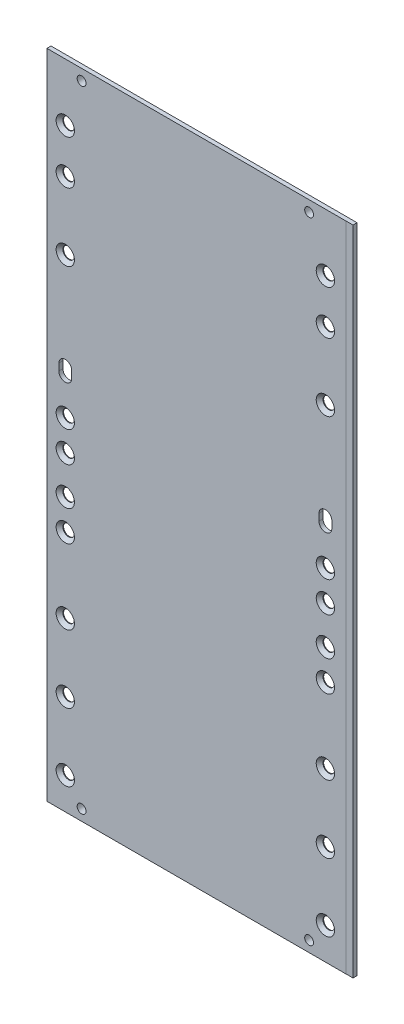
SolidWorks part; units mm, degrees
ref_plane "Front Plane" through (0, 0, 0) normal (0, 0, 1) x (1, 0, 0)
ref_plane "Top Plane" through (0, 0, 0) normal (0, 1, 0) x (1, 0, 0)
ref_plane "Right Plane" through (0, 0, 0) normal (1, 0, 0) x (0, 0, -1)
sketch "Sketch1" plane through (0, 0, 0) normal (0, 0, 1) x (1, 0, 0)
  line L0 (-36.4319, 3.9744) -> (-36.4319, 1.9744) construction
  line L1 (-41.8319, 82.5744) -> (48.3681, 82.5744)
  line L2 (-41.8319, 82.5744) -> (-41.8319, -109.6256)
  line L3 (-41.8319, -109.6256) -> (48.3681, -109.6256)
  line L4 (48.3681, 82.5744) -> (48.3681, -109.6256)
  line L5 (-34.5319, 3.9744) -> (-34.5319, 1.9744)
  line L6 (-38.3319, 3.9744) -> (-38.3319, 1.9744)
  circle A0 centre (-31.6319, 79.3744) radius 1.3
  circle A1 centre (-36.4319, 65.5744) radius 1.7
  circle A2 centre (-36.4319, 52.5744) radius 1.7
  circle A3 centre (-36.4319, 32.5744) radius 1.7
  circle A4 centre (-36.4319, -9.0256) radius 1.7
  circle A5 centre (-36.4319, -18.0256) radius 1.7
  circle A6 centre (-36.4319, -29.2256) radius 1.7
  circle A7 centre (-36.4319, -38.2256) radius 1.7
  circle A8 centre (-36.4319, -60.2256) radius 1.7
  circle A9 centre (-36.4319, -80.2256) radius 1.7
  circle A10 centre (-36.4319, -100.2256) radius 1.7
  arc A11 (-34.5319, 3.9744) -> (-38.3319, 3.9744) centre (-36.4319, 3.9744) ccw
  arc A12 (-38.3319, 1.9744) -> (-34.5319, 1.9744) centre (-36.4319, 1.9744) ccw
  circle A13 centre (-31.6319, -106.4256) radius 1.3
  point P28 (-36.4319, 2.9744)
  point P35 (-36.4319, 0.0744)
  point P36 (-36.4319, 5.8744)
  point P37 (-38.3319, 2.9744)
  dimension "D3" = 2.6
  dimension "D4" = 3.4
  dimension "D5" = 3.4
  dimension "D6" = 3.4
  dimension "D7" = 3.4
  dimension "D8" = 3.4
  dimension "D9" = 3.4
  dimension "D10" = 3.4
  dimension "D11" = 3.4
  dimension "D12" = 3.4
  dimension "D13" = 3.4
  dimension "D14" = 2.6
  dimension "D1" = 90.2
  dimension "D2" = 192.2
  dimension "D15" = 3.2
  dimension "D16" = 3.2
  dimension "D17" = 10.2
  dimension "D18" = 10.2
  dimension "D19" = 5.4
  dimension "D20" = 5.4
  dimension "D21" = 5.4
  dimension "D22" = 5.4
  dimension "D23" = 5.8
  dimension "D24" = 3.8
  dimension "D25" = 5.4
  dimension "D26" = 5.4
  dimension "D27" = 5.4
  dimension "D28" = 5.4
  dimension "D29" = 5.4
  dimension "D30" = 5.4
  dimension "D31" = 5.4
  dimension "D32" = 17
  dimension "D33" = 13
  dimension "D34" = 20
  dimension "D35" = 26.7
  dimension "D36" = 11.2
  dimension "D37" = 9
  dimension "D38" = 22
  dimension "D39" = 9
  dimension "D40" = 20
  dimension "D41" = 20
  dimension "D42" = 9.4
extrude "Boss-Extrude1" add sketch "Sketch1" along normal blind 1.2
ref_plane "Plane1" through (1.9, 0, 0) normal (1, 0, 0) x (0, 0, -1)
mirror "Mirror3" about plane through (1.9, 0, 0) normal (1, 0, 0) of "Boss-Extrude1"
sketch "Sketch3" plane through (0, 0, 0) normal (0, 0, 1) x (1, 0, 0)
  circle A0 centre (-31.6319, 79.3744) radius 1.3
  circle A1 centre (35.4319, 79.3744) radius 1.3
  circle A2 centre (35.4319, -106.4256) radius 1.3
  circle A3 centre (-31.6319, -106.4256) radius 1.3
extrude "Extrude-Thin1" add sketch "Sketch3" against normal blind 1 thin
hole_wizard "CSK for M3 Flat Head Machine Screw1" positions "Sketch4" profile "Sketch5" countersink size "M3" standard "ANSI Metric"
sketch "Sketch4" plane through (0, 0, 1.2) normal (0, 0, 1) x (1, 0, 0)
  point P0 (-36.4319, 65.5744)
  point P3 (-36.4319, 52.5744)
  point P6 (-36.4319, 32.5744)
  point P9 (-36.4319, -9.0256)
  point P12 (-36.4319, -18.0256)
  point P15 (-36.4319, -29.2256)
  point P18 (-36.4319, -38.2256)
  point P21 (-36.4319, -60.2256)
  point P24 (-36.4319, -80.2256)
  point P27 (-36.4319, -100.2256)
  point P30 (40.2319, -100.2256)
  point P33 (40.2319, -80.2256)
  point P36 (40.2319, -60.2256)
  point P39 (40.2319, -38.2256)
  point P42 (40.2319, -29.2256)
  point P45 (40.2319, -18.0256)
  point P48 (40.2319, -9.0256)
  point P51 (40.2319, 32.5744)
  point P54 (40.2319, 52.5744)
  point P57 (40.2319, 65.5744)
sketch "Sketch5" plane through (-36.4319, 65.5744, 1.2) normal (1, 0, 0) x (0, -1, 0)
  line L0 (0, 0) -> (0, 15.0215)
  line L1 (0, 15.0215) -> (1.7, 14)
  line L2 (1.7, 14) -> (1.7, 1)
  line L3 (1.7, 1) -> (2.7, 0)
  line L5 (2.7, 0) -> (0, 0)
  line L6 (-1.7, 1) -> (-2.7, 0) construction
  line L10 (0, 15.0215) -> (-1.7, 14) construction
  line L11 (0, -6.35) -> (0, 107.95) construction
  dimension "Hole Dia." = 3.4
  dimension "Hole Depth" = 14
  dimension "Near C'Sink Dia." = 5.4
  dimension "Near C'Sink Angle" = 90
  dimension "Drill Angle" = 118
ref_plane "Plane2" through (0, 0, 1.2) normal (0, 0, 1) x (1, 0, 0)
sketch "Sketch6" plane through (0, 0, 1.2) normal (0, 0, 1) x (1, 0, 0)
  line L0 (-41.8319, -109.6256) -> (48.3681, -109.6256) construction
  line L1 (48.3681, 82.5744) -> (46.3681, 82.5744)
  line L2 (48.3681, 82.5744) -> (48.3681, -109.6256)
  line L3 (48.3681, -109.6256) -> (46.3681, -109.6256)
  line L4 (46.3681, 82.5744) -> (46.3681, -109.6256)
  dimension "D1" = 2
extrude "Cut-Extrude1" cut sketch "Sketch6" against normal blind 0.01
sketch "Sketch7" plane through (0, 0, 0) normal (0, 0, 1) x (1, 0, 0)
  line L1 (48.3681, 82.5744) -> (46.3681, 82.5744)
  line L2 (48.3681, 82.5744) -> (48.3681, -109.6256)
  line L3 (48.3681, -109.6256) -> (46.3681, -109.6256)
  line L4 (46.3681, 82.5744) -> (46.3681, -109.6256)
extrude "Cut-Extrude2" cut sketch "Sketch7" along normal blind 0.01
